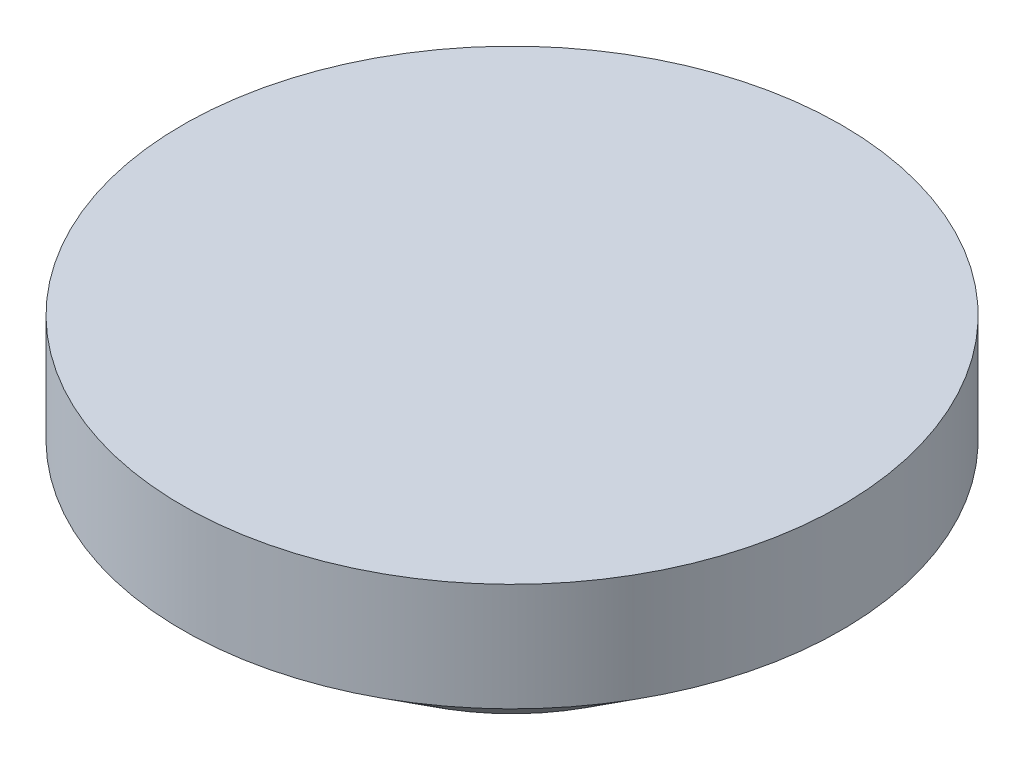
SolidWorks part; units mm, degrees
ref_plane "前视基准面" through (0, 0, 0) normal (0, 0, 1) x (1, 0, 0)
ref_plane "上视基准面" through (0, 0, 0) normal (0, 1, 0) x (1, 0, 0)
ref_plane "右视基准面" through (0, 0, 0) normal (1, 0, 0) x (0, 0, -1)
sketch "草图1" plane through (0, 0, 0) normal (0, 0, 1) x (1, 0, 0)
  line L0 (0, 0) -> (0, 528.9135) construction
  line L1 (0, 710) -> (1100, 710)
  line L2 (1100, 710) -> (1100, 350)
  line L3 (1100, 350) -> (625, 0)
  line L4 (625, 0) -> (0, 0)
  line L5 (0, 0) -> (0, 710)
  dimension "D1" = 360
  dimension "D2" = 350
  dimension "D3" = 2200
  dimension "D4" = 1250
revolve "旋转1" add sketch "草图1" angle 360 about L0
